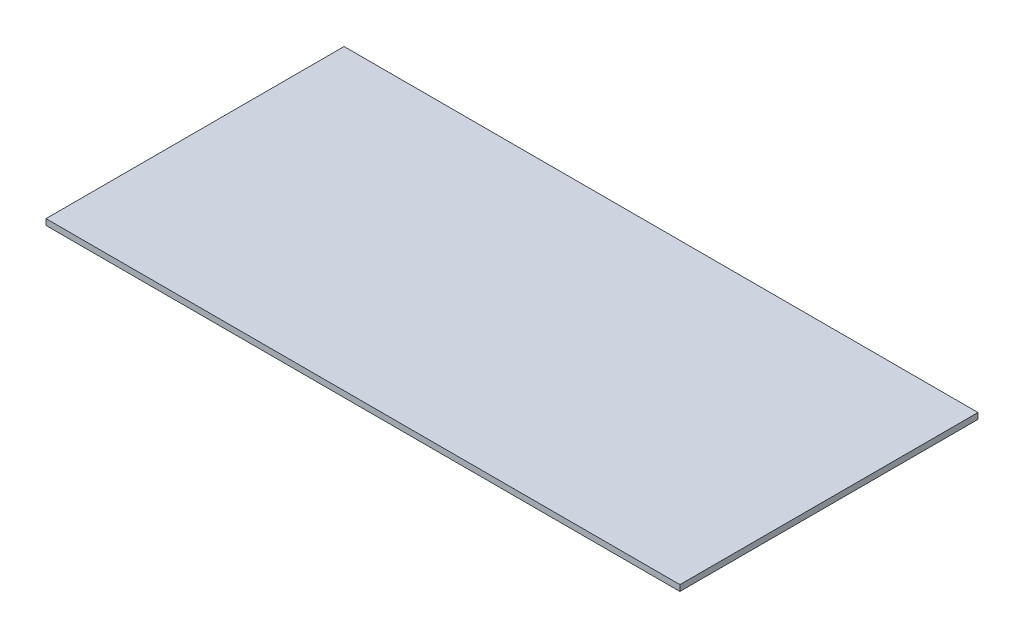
SolidWorks part; units mm, degrees
ref_plane "Front Plane" through (0, 0, 0) normal (0, 0, 1) x (1, 0, 0)
ref_plane "Top Plane" through (0, 0, 0) normal (0, 1, 0) x (1, 0, 0)
ref_plane "Right Plane" through (0, 0, 0) normal (1, 0, 0) x (0, 0, -1)
sketch "Sketch1" plane through (0, 0, 0) normal (0, 1, 0) x (1, 0, 0)
  line L1 (-319, -150) -> (319, -150)
  line L2 (-319, -150) -> (-319, 150)
  line L3 (-319, 150) -> (319, 150)
  line L4 (319, -150) -> (319, 150)
  line L5 (-319, -150) -> (319, 150) construction
  line L6 (-319, 150) -> (319, -150) construction
  point P0 (0, 0)
  dimension "D1" = 638
  dimension "D2" = 300
extrude "Boss-Extrude1" add sketch "Sketch1" along normal blind 6
sketch "Sketch3" plane through (0, 6, 0) normal (0, 1, 0) x (1, 0, 0)
  line L0 (319, 150) -> (-319, 150) construction
  line L1 (214, 100) -> (289, 100)
  line L2 (214, 100) -> (214, 55)
  line L3 (214, 55) -> (289, 55)
  line L4 (289, 100) -> (289, 55)
  line L5 (319, -150) -> (319, 150) construction
  dimension "D1" = 75
  dimension "D2" = 45
  dimension "D3" = 50
  dimension "D4" = 30
extrude "Cut-Extrude1" [suppressed] cut sketch "Sketch3" against normal blind 6
